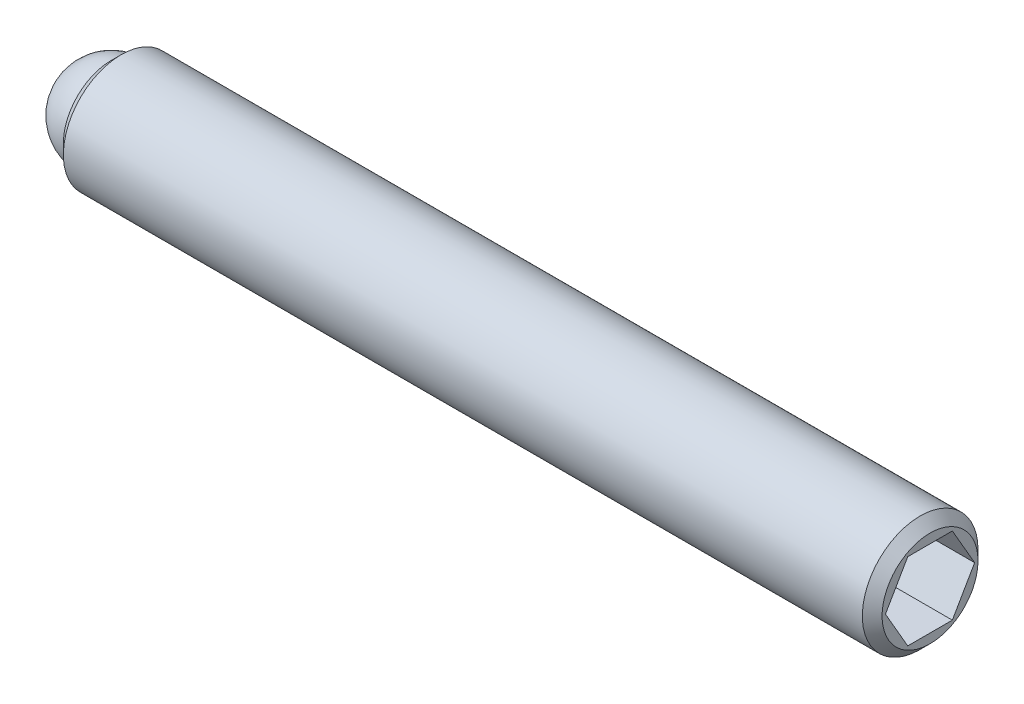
SolidWorks part; units mm, degrees
ref_plane "Front Plane" through (0, 0, 0) normal (0, 0, 1) x (1, 0, 0)
ref_plane "Top Plane" through (0, 0, 0) normal (0, 1, 0) x (1, 0, 0)
ref_plane "Right Plane" through (0, 0, 0) normal (1, 0, 0) x (0, 0, -1)
sketch "Sketch2" plane through (0, 0, 0) normal (1, 0, 0) x (0, 0, -1)
  circle A0 centre (0, 0) radius 1.4859
  dimension "D1" = 2.9718
extrude "Boss-Extrude1" add sketch "Sketch2" along normal blind 21.0344
sketch "Sketch3" plane through (0, 0, 0) normal (-1, 0, 0) x (0, 0, 1)
  circle A0 centre (0, 0) radius 1.1906
  dimension "D1" = 2.3813
chamfer "Chamfer1" distance 0.254 angle 45 1 edges at (0, 0, -1.4859)
chamfer "Chamfer2" distance 0.254 angle 45 1 edges at (21.0344, 0, -1.4859)
sketch "Sketch4" plane through (21.0344, 0, 0) normal (1, 0, 0) x (0, 0, -1)
  line L1 (1.1457, 0) -> (0.5728, 0.9922)
  line L2 (0.5728, 0.9922) -> (-0.5728, 0.9922)
  line L3 (-0.5728, 0.9922) -> (-1.1457, 0)
  line L4 (-1.1457, 0) -> (-0.5728, -0.9922)
  line L5 (-0.5728, -0.9922) -> (0.5728, -0.9922)
  line L6 (0.5728, -0.9922) -> (1.1457, 0)
  circle A0 centre (0, 0) radius 0.9922 construction
extrude "Cut-Extrude2" cut sketch "Sketch4" against normal blind 2.286
extrude "Cut-Extrude3" cut sketch "Sketch3" against normal blind 1.1906
sketch "Sketch5" plane through (0, 0, 0) normal (-1, 0, 0) x (0, 0, 1)
  line L0 (0, 0) -> (0, -1.1906)
  line L1 (0, 0) -> (0, 1.1906)
  arc A0 (0, 1.1906) -> (0, -1.1906) centre (0, 0) ccw
  dimension "D1" = 1.1906
revolve "Revolve1" add sketch "Sketch5" angle 360 about L1
